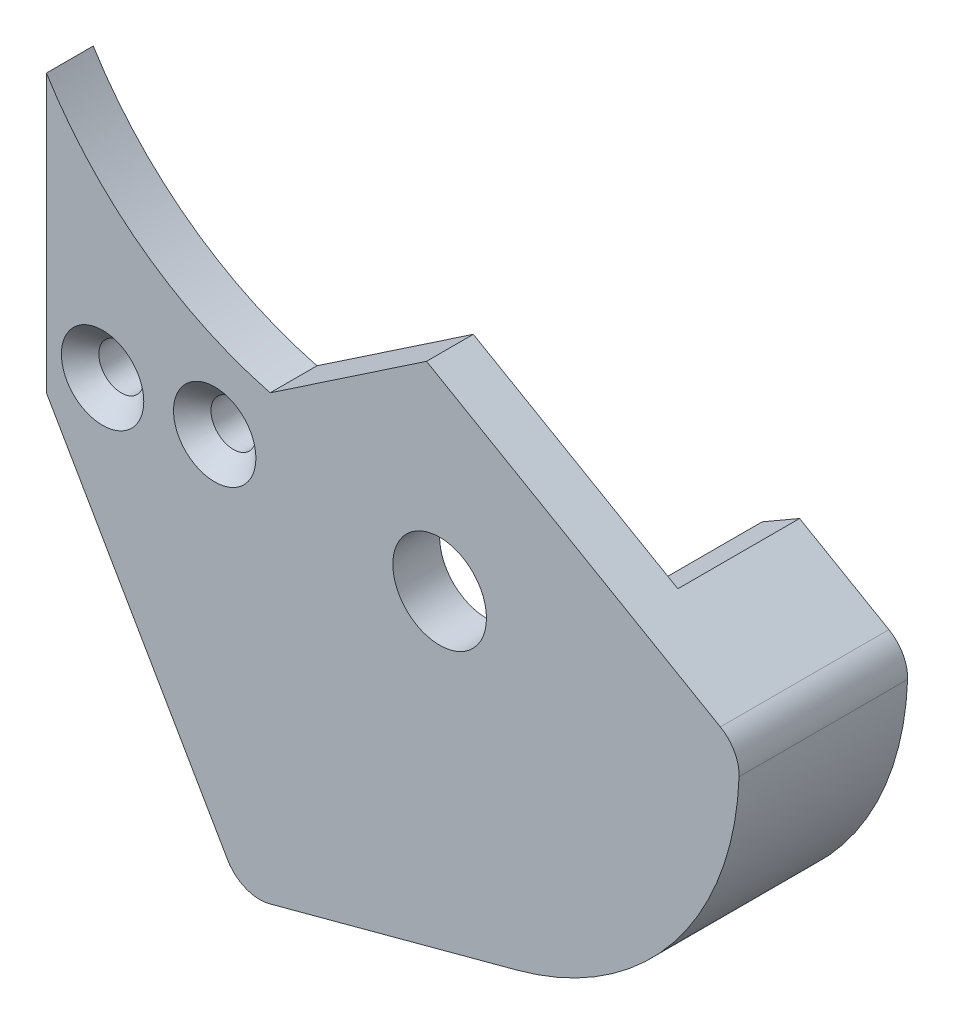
SolidWorks part; units mm, degrees
ref_plane "Plan de face" through (0, 0, 0) normal (0, 0, 1) x (1, 0, 0)
ref_plane "Plan de dessus" through (0, 0, 0) normal (0, 1, 0) x (1, 0, 0)
ref_plane "Plan de droite" through (0, 0, 0) normal (1, 0, 0) x (0, 0, -1)
sketch "Esquisse1" plane through (0, 0, 0) normal (0, 0, 1) x (1, 0, 0)
  line L0 (18, 42.1769) -> (27.6668, 25.4335)
  line L1 (29.9165, 24.5017) -> (43.1411, 28.0452)
  line L4 (49.2205, 47.4738) -> (53.9906, 44.7198)
  line L6 (19.7321, 43.1769) -> (28.6315, 27.7626)
  line L7 (30.8812, 26.8307) -> (42.6235, 29.977)
  line L8 (47.2205, 46.3191) -> (51.8915, 43.6223)
  line L9 (47.2205, 46.3191) -> (49.2205, 47.4738)
  line L11 (19.7321, 43.1769) -> (18, 42.1769)
  line L12 (48.2205, 48.0512) -> (54.987, 44.1445) construction
  line L13 (28.4341, 24.1045) -> (43.1411, 28.0452) construction
  line L14 (18, 42.1769) -> (28.4341, 24.1045) construction
  line L15 (47.2205, 46.3191) -> (52.9906, 42.9877) construction
  line L16 (29.3989, 26.4335) -> (42.6235, 29.977) construction
  line L17 (19.7321, 43.1769) -> (29.3989, 26.4335) construction
  arc A0 (43.1411, 28.0452) -> (54.9893, 42.9146) centre (39, 43.5) ccw
  arc A1 (42.6235, 29.977) -> (52.8735, 41.622) centre (39, 43.5) ccw
  arc A2 (43.1411, 28.0452) -> (54.987, 44.1445) centre (39, 43.5) ccw construction
  arc A3 (53.9906, 44.7198) -> (54.9893, 42.9146) centre (52.9906, 42.9877) cw
  arc A4 (29.9165, 24.5017) -> (27.6668, 25.4335) centre (29.3989, 26.4335) cw
  arc A5 (42.6235, 29.977) -> (52.9906, 42.9877) centre (39, 43.5) ccw construction
  arc A6 (51.8915, 43.6223) -> (52.8735, 41.622) centre (50.8915, 41.8903) cw
  arc A7 (30.8812, 26.8307) -> (28.6315, 27.7626) centre (30.3636, 28.7626) cw
  dimension "D1" = 16
  dimension "D6" = 2
  dimension "D5" = 2
extrude "Boss.-Extru.1" add sketch "Esquisse1" along normal blind 6.5
sketch "Esquisse2" plane through (0, 0, 6.5) normal (0, 0, 1) x (1, 0, 0)
  line L0 (18, 42.1769) -> (27.6668, 25.4335)
  line L1 (29.9165, 24.5017) -> (43.1411, 28.0452)
  line L3 (18, 42.1769) -> (18, 56.9643)
  line L4 (38.2976, 53.7802) -> (53.9906, 44.7198)
  line L6 (29.9165, 24.5017) -> (43.1411, 28.0452) construction
  line L7 (18, 42.1769) -> (27.6668, 25.4335) construction
  line L9 (53.9906, 44.7198) -> (49.2205, 47.4738) construction
  line L10 (0, 0) -> (0, 98.4406) construction
  line L11 (38.2976, 53.7802) -> (29.9481, 48.1485)
  line L13 (-13.2779, 71) -> (74.8729, 71) construction
  arc A0 (43.1411, 28.0452) -> (54.9893, 42.9146) centre (39, 43.5) ccw
  arc A1 (18, 56.9643) -> (29.9481, 48.1485) centre (35, 67.5) ccw
  circle A2 centre (39, 43.5) radius 2.5
  arc A3 (53.9906, 44.7198) -> (54.9893, 42.9146) centre (52.9906, 42.9877) cw
  arc A4 (29.9165, 24.5017) -> (27.6668, 25.4335) centre (29.3989, 26.4335) cw
  arc A6 (43.1411, 28.0452) -> (54.9893, 42.9146) centre (39, 43.5) ccw construction
  point P2 (51.431, 30.7024)
  point P12 (44.1369, 34.9136)
  dimension "D1" = 39
  dimension "D6" = 2
  dimension "D2" = 20
  dimension "D4" = 71
  dimension "D5" = 3.5
  dimension "D3" = 35
extrude "Boss.-Extru.2" add sketch "Esquisse2" along normal blind 2.5
sketch "Esquisse3" plane through (31.7631, 18.3385, 0) normal (-0.866, -0.5, 0) x (0, 0, 1)
  line L0 (0, 27.5263) -> (0, 8.1927) construction
  line L1 (6.5, 27.5263) -> (0, 27.5263) construction
  circle A0 centre (2.5, 17.5263) radius 3
  dimension "D1" = 6
  dimension "D2" = 2.5
  dimension "D3" = 10
extrude "Enlèv. mat.-Extru.1" cut sketch "Esquisse3" against normal blind 2.5
sketch "Esquisse4" plane through (0, 0, 0) normal (0, 0, -1) x (-1, 0, 0)
  line L0 (-18, 42.1769) -> (-33.377, 43.1457)
  line L1 (-33.377, 43.1457) -> (-15.812, 47.7646)
  line L2 (-15.812, 47.7646) -> (-18, 42.1769)
extrude "Enlèv. mat.-Extru.2" cut sketch "Esquisse4" against normal blind 6.5
hole_wizard "Fraisage pour vis à tête fraisée M21" positions "Esquisse8" profile "Esquisse7" countersink size "M2" standard "Iso"
sketch "Esquisse8" plane through (0, 0, 9) normal (0, 0, 1) x (1, 0, 0)
  line L0 (18, 56.9643) -> (18, 42.1769) construction
  line L1 (20.2283, 42.3173) -> (18, 42.1769) construction
  point P0 (21, 44.3699)
  dimension "D1" = 3
  dimension "D2" = 2
sketch "Esquisse7" plane through (21, 44.3699, 9) normal (1, 0, 0) x (0, -1, 0)
  line L0 (0, 0) -> (0, 9)
  line L1 (0, 9) -> (1.2, 9)
  line L2 (1.2, 9) -> (1.2, 1)
  line L3 (1.2, 1) -> (2.2, 0)
  line L5 (2.2, 0) -> (0, 0)
  line L6 (-1.2, 1) -> (-2.2, 0) construction
  line L11 (0, -6.35) -> (0, 107.95) construction
  dimension "Diamètre du perçage jusqu'au prochain" = 2.4
  dimension "Profondeur du perçage jusqu'au prochain" = 9
  dimension "Diamètre du fraisage entrant" = 4.4
  dimension "Angle du fraisage entrant" = 90
pattern_linear "Répétition linéaire1" count 2 spacing 6 along (0.998, 0.0629, 0) of "Fraisage pour vis à tête fraisée M21"
